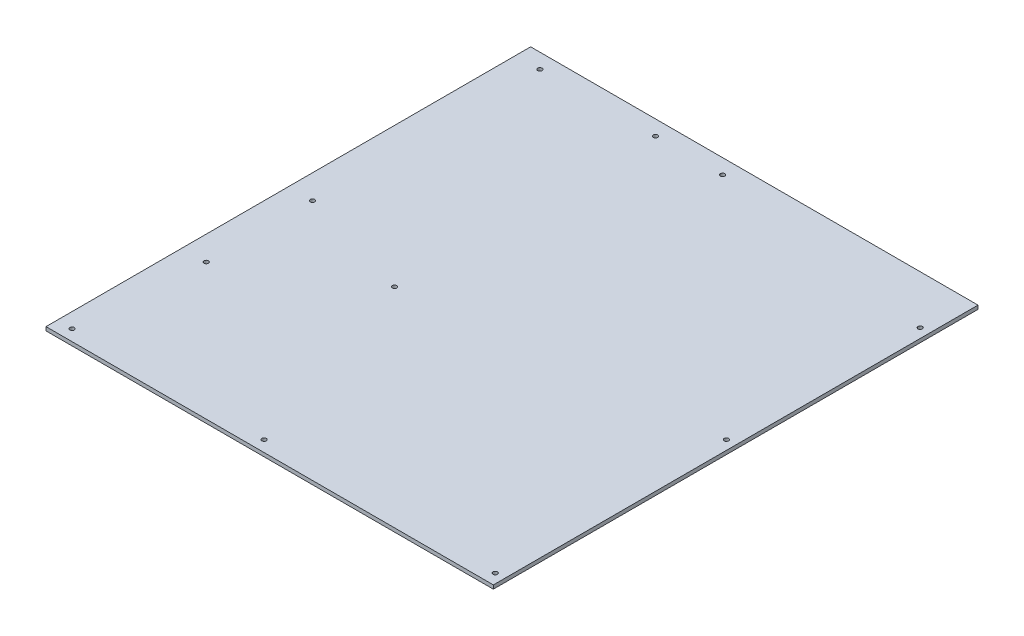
SolidWorks part; units mm, degrees
ref_plane "Спереди" through (0, 0, 0) normal (0, 0, 1) x (1, 0, 0)
ref_plane "Сверху" through (0, 0, 0) normal (0, 1, 0) x (1, 0, 0)
ref_plane "Справа" through (0, 0, 0) normal (1, 0, 0) x (0, 0, -1)
sketch "Sketch1" plane through (0, 0, 0) normal (0, 1, 0) x (1, 0, 0)
  line L1 (-152.4, 0) -> (152.4, 0)
  line L2 (-152.4, 0) -> (-152.4, 330.2)
  line L3 (-152.4, 330.2) -> (152.4, 330.2)
  line L4 (152.4, 0) -> (152.4, 330.2)
  dimension "D1" = 304.8
  dimension "D2" = 330.2
extrude "Extrude1" add sketch "Sketch1" along normal blind 2.54
hole_wizard "Ø3.0 (3) Diameter Hole1" positions "Sketch3" profile "Sketch2" hole size "Ø3.0" standard "ISO"
sketch "Sketch3" plane through (0, 2.54, 0) normal (0, 1, 0) x (1, 0, 0)
  line L0 (152.4, 330.2) -> (-152.4, 330.2) construction
  line L1 (-152.4, 330.2) -> (-152.4, 0) construction
  point P0 (-135.89, 320.04)
  point P6 (-135.89, 92.71)
  point P9 (-142.24, 7.62)
  point P14 (-57.15, 142.24)
  point P28 (-11.43, 320.04)
  point P31 (146.05, 297.18)
  point P34 (146.05, 165.1)
  point P37 (146.05, 7.62)
  point P40 (-57.15, 320.04)
  point P53 (-11.43, 7.62)
  point P58 (-135.89, 165.1)
  dimension "D1" = 10.16
  dimension "D2" = 16.51
  dimension "D3" = 227.33
  dimension "D4" = 10.16
  dimension "D5" = 312.42
  dimension "D6" = 177.8
  dimension "D7" = 78.74
  dimension "D8" = 124.46
  dimension "D9" = 22.86
  dimension "D10" = 281.94
  dimension "D11" = 154.94
  dimension "D12" = 154.94
sketch "Sketch2" plane through (-135.89, 2.54, -320.04) normal (1, 0, 0) x (0, 0, 1)
  line L0 (0, 0) -> (0, 3.9493)
  line L1 (0, 3.9493) -> (1.5, 3.048)
  line L2 (1.5, 3.048) -> (1.5, 0)
  line L5 (1.5, 0) -> (0, 0)
  line L10 (0, 3.9493) -> (-1.5, 3.048) construction
  line L11 (0, -6.35) -> (0, 107.95) construction
  dimension "Hole Dia." = 3
  dimension "Hole Depth" = 3.048
  dimension "Drill Angle" = 118
